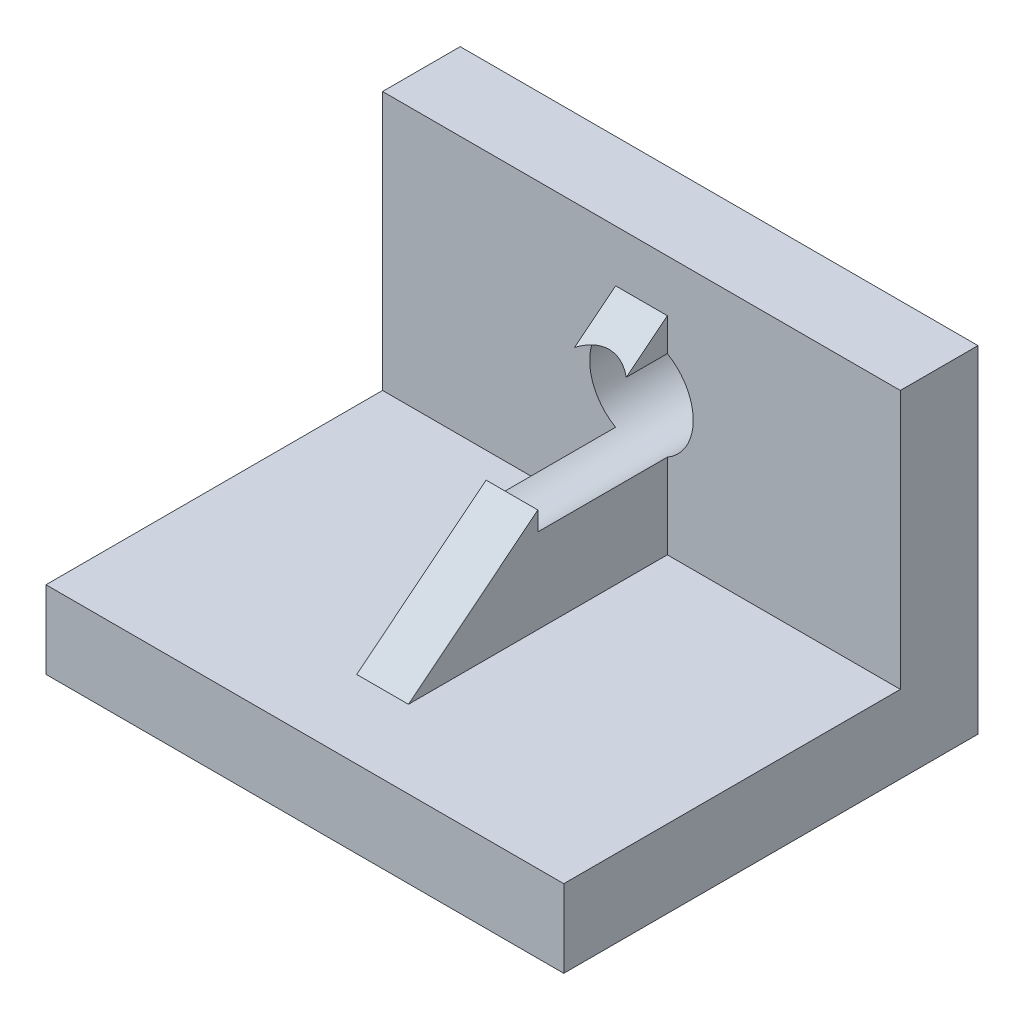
SolidWorks part; units mm, degrees
ref_plane "前视基准面" through (0, 0, 0) normal (0, 0, 1) x (1, 0, 0)
ref_plane "上视基准面" through (0, 0, 0) normal (0, 1, 0) x (1, 0, 0)
ref_plane "右视基准面" through (0, 0, 0) normal (1, 0, 0) x (0, 0, -1)
other "Configuration Table"
sketch "草图1" plane through (0, 0, 0) normal (0, 1, 0) x (1, 0, 0)
  line L1 (-50, -40) -> (50, -40)
  line L2 (-50, -40) -> (-50, 40)
  line L3 (-50, 40) -> (50, 40)
  line L4 (50, -40) -> (50, 40)
  line L5 (-50, -40) -> (50, 40) construction
  line L6 (-50, 40) -> (50, -40) construction
  point P0 (0, 0)
extrude "凸台-拉伸1" add sketch "草图1" along normal blind 15
sketch "草图2" plane through (0, 15, 0) normal (0, 1, 0) x (1, 0, 0)
  line L1 (-50, 25) -> (50, 25)
  line L2 (-50, 25) -> (-50, 40)
  line L3 (-50, 40) -> (50, 40)
  line L4 (50, 25) -> (50, 40)
  line L5 (-50, 25) -> (50, 40) construction
  line L6 (-50, 40) -> (50, 25) construction
  point P0 (0, 32.5)
extrude "凸台-拉伸2" add sketch "草图2" along normal blind 50
sketch "草图3" plane through (0, 0, 0) normal (1, 0, 0) x (0, 0, -1)
  line L0 (25, 15) -> (-25, 15)
  line L1 (-40, 15) -> (25, 15) construction
  line L2 (-25, 15) -> (25, 55)
  line L3 (25, 65) -> (25, 15) construction
  line L4 (25, 55) -> (25, 15)
extrude "凸台-拉伸3" add sketch "草图3" against normal mid plane 10
sketch "草图4" plane through (0, 0, 0) normal (0, 0, 1) x (1, 0, 0)
  circle A0 centre (0, 40) radius 10
extrude "切除-拉伸1" cut sketch "草图4" against normal blind 50
